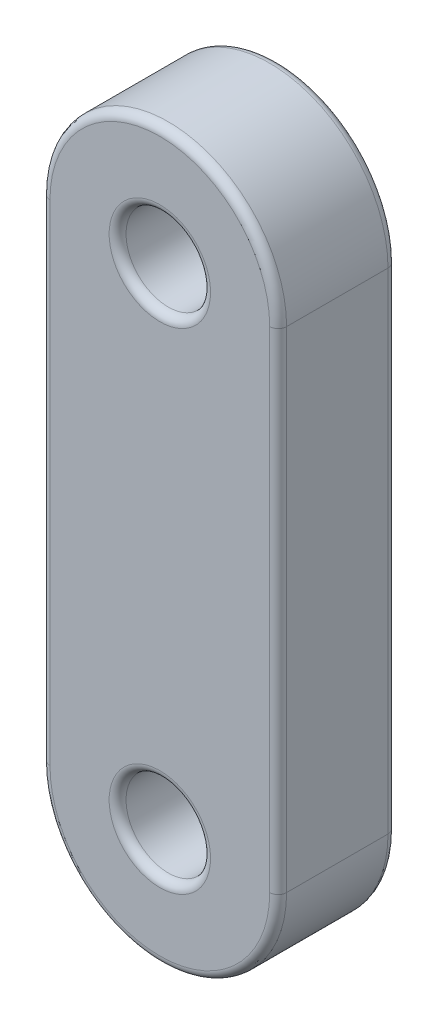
SolidWorks part; units mm, degrees
ref_plane "Спереди" through (0, 0, 0) normal (0, 0, 1) x (1, 0, 0)
ref_plane "Сверху" through (0, 0, 0) normal (0, 1, 0) x (1, 0, 0)
ref_plane "Справа" through (0, 0, 0) normal (1, 0, 0) x (0, 0, -1)
sketch "Эскиз1" plane through (0, 0, 0) normal (0, 0, 1) x (1, 0, 0)
  line L0 (0, 0) -> (0, 14.5) construction
  line L1 (0, 0) -> (0, -14.5) construction
  line L2 (-7, 14.5) -> (-7, -14.5)
  line L3 (7, 14.5) -> (7, -14.5)
  circle A0 centre (0, 14.5) radius 2.5
  circle A1 centre (0, -14.5) radius 2.5
  arc A2 (7, 14.5) -> (-7, 14.5) centre (0, 14.5) ccw
  arc A3 (-7, -14.5) -> (7, -14.5) centre (0, -14.5) ccw
  dimension "D2" = 5
  dimension "D3" = 14
  dimension "D1" = 29
extrude "Бобышка-Вытянуть1" add sketch "Эскиз1" along normal mid plane 7
fillet "Скругление1" radius 0.5 12 edges at (2.5, -14.5, -3.5) (-7, 0, -3.5) (0, -21.5, -3.5) (7, 0, -3.5) (0, 21.5, -3.5) (2.5, 14.5, -3.5) (2.5, -14.5, 3.5) (7, 0, 3.5) (0, -21.5, 3.5) (-7, 0, 3.5) (0, 21.5, 3.5) (2.5, 14.5, 3.5)
